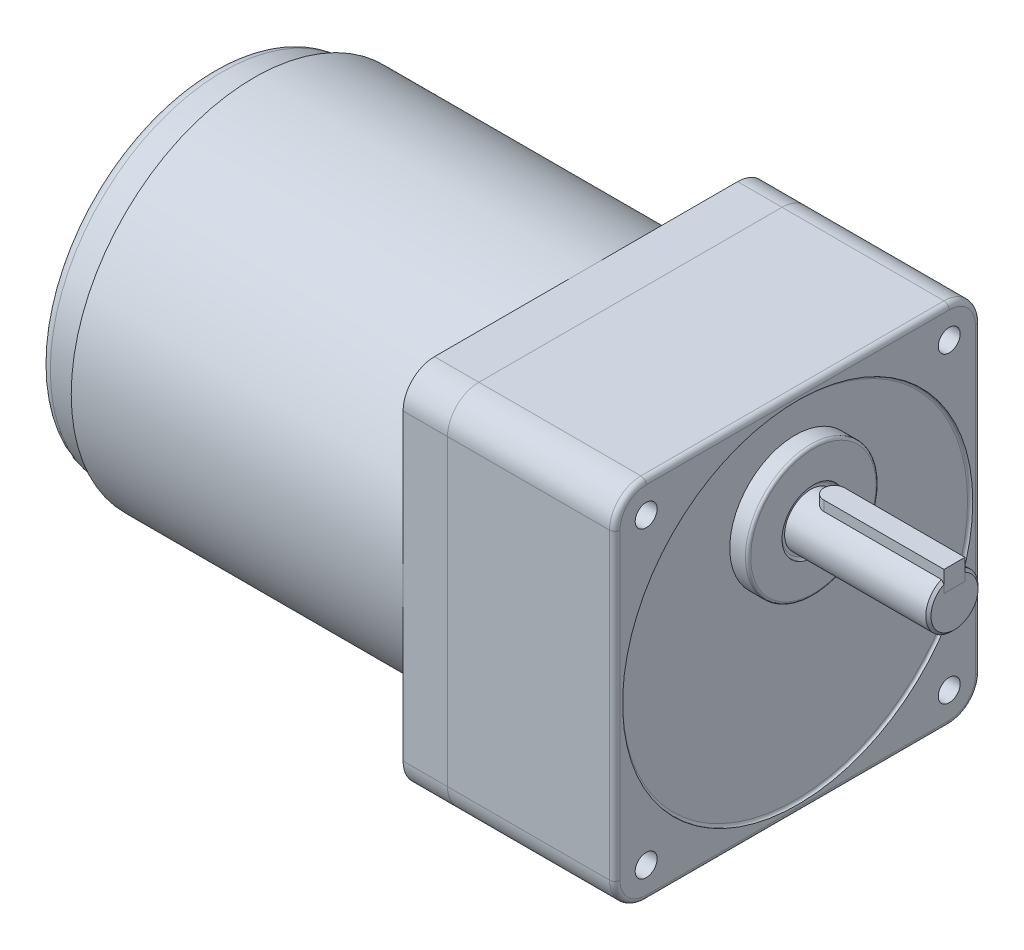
SolidWorks part; units mm, degrees
ref_plane "前视基准面" through (0, 0, 0) normal (0, 0, 1) x (1, 0, 0)
ref_plane "上视基准面" through (0, 0, 0) normal (0, 1, 0) x (1, 0, 0)
ref_plane "右视基准面" through (0, 0, 0) normal (1, 0, 0) x (0, 0, -1)
sketch "草图1" plane through (0, 0, 0) normal (1, 0, 0) x (0, 0, -1)
  line L1 (-29, -35) -> (29, -35)
  line L2 (-35, -29) -> (-35, 29)
  line L3 (-29, 35) -> (29, 35)
  line L4 (35, -29) -> (35, 29)
  line L5 (-35, -35) -> (35, 35) construction
  line L6 (-35, 35) -> (35, -35) construction
  arc A0 (-29, -35) -> (-35, -29) centre (-29, -29) cw
  arc A1 (29, -35) -> (35, -29) centre (29, -29) ccw
  arc A2 (29, 35) -> (35, 29) centre (29, 29) cw
  arc A3 (-35, 29) -> (-29, 35) centre (-29, 29) cw
  point P0 (0, 0)
  dimension "D1" = 6
extrude "凸台-拉伸1" add sketch "草图1" against normal blind 32
sketch "草图2" plane through (-32, 0, 0) normal (-1, 0, 0) x (0, 0, 1)
  line L0 (-29, 35) -> (29, 35) construction
  line L1 (-29, -35) -> (29, -35)
  line L2 (-35, -29) -> (-35, 29)
  line L3 (-29, 35) -> (29, 35)
  line L4 (35, -29) -> (35, 29)
  line L5 (-35, -35) -> (35, 35) construction
  line L6 (-35, 35) -> (35, -35) construction
  arc A0 (29, 35) -> (35, 29) centre (29, 29) cw
  arc A1 (29, -35) -> (35, -29) centre (29, -29) ccw
  arc A2 (-29, -35) -> (-35, -29) centre (-29, -29) cw
  arc A3 (-35, 29) -> (-29, 35) centre (-29, 29) cw
  point P0 (0, 0)
  dimension "D1" = 6
extrude "凸台-拉伸2" add sketch "草图2" along normal blind 8.5 separate body
sketch "草图3" plane through (-40.5, 0, 0) normal (-1, 0, 0) x (0, 0, 1)
  circle A0 centre (0, 0) radius 35
extrude "凸台-拉伸3" add sketch "草图3" along normal blind 63.5
sketch "草图4" plane through (-104, 0, 0) normal (-1, 0, 0) x (0, 0, 1)
  circle A0 centre (0, 0) radius 33
extrude "凸台-拉伸4" add sketch "草图4" along normal blind 8
fillet "圆角1" radius 2 1 edges at (-112, 0, 33)
fillet "圆角2" radius 1 8 edges at (0, 0, 35) (0, 33.2426, 33.2426) (0, 35, 0) (0, 33.2426, -33.2426) (0, 0, -35) (0, -33.2426, -33.2426) (0, -35, 0) (0, -33.2426, 33.2426)
sketch "草图5" plane through (0, 0, 0) normal (1, 0, 0) x (0, 0, -1)
  point P10 (-28.9914, 28.9914)
  point P11 (28.9914, 28.9914)
  point P12 (28.9914, -28.9914)
  point P13 (-28.9914, -28.9914)
hole_wizard "M5 螺纹孔1" positions "3D草图1" profile "草图6" tap size "M5" standard "GB"
sketch3d "3D草图1"
  point P0 (0, 28.9914, 28.9914)
  point P3 (0, 28.9914, -28.9914)
  point P6 (0, -28.9914, -28.9914)
  point P9 (0, -28.9914, 28.9914)
sketch "草图6" plane through (0, 28.9914, 28.9914) normal (0, 1, 0) x (0, 0, -1)
  line L0 (0, 0) -> (0, 15.2618)
  line L1 (0, 15.2618) -> (2.1, 14)
  line L2 (2.1, 14) -> (2.1, 0)
  line L5 (2.1, 0) -> (0, 0)
  line L10 (0, 15.2618) -> (-2.1, 14) construction
  line L11 (0, -6.35) -> (0, 107.95) construction
  dimension "螺纹孔钻头直径" = 4.2
  dimension "螺纹孔钻头深度" = 14
  dimension "导头角度" = 118
sketch "草图7" plane through (0, 0, 0) normal (1, 0, 0) x (0, 0, -1)
  circle A0 centre (0, 0) radius 33.5
extrude "切除-拉伸1" cut sketch "草图7" against normal blind 0.5
fillet "圆角3" radius 0.5 1 edges at (-0.5, 0, -33.5)
sketch "草图8" plane through (-0.5, 0, 0) normal (1, 0, 0) x (0, 0, -1)
  circle A0 centre (0, 15) radius 12.5
extrude "凸台-拉伸5" add sketch "草图8" along normal blind 3.5
fillet "圆角4" radius 0.5 1 edges at (3, 15, -12.5)
sketch "草图9" plane through (3, 0, 0) normal (1, 0, 0) x (0, 0, -1)
  circle A0 centre (0, 15) radius 6
extrude "切除-拉伸2" cut sketch "草图9" against normal blind 0.5
fillet "圆角5" radius 0.5 1 edges at (2.5, 15, -6)
sketch "草图10" plane through (2.5, 0, 0) normal (1, 0, 0) x (0, 0, -1)
  circle A0 centre (0, 15) radius 5
extrude "凸台-拉伸6" add sketch "草图10" along normal blind 27.5
ref_plane "基准面1" through (0, 20, 0) normal (0, 1, 0) x (1, 0, 0)
sketch "草图11" plane through (0, 20, 0) normal (0, 1, 0) x (1, 0, 0)
  line L1 (30, -5) -> (30, 5) construction
  line L2 (7, 2) -> (30, 2)
  line L3 (30, 2) -> (30, -2)
  line L4 (30, -2) -> (7, -2)
  arc A0 (7, 2) -> (7, -2) centre (7, 0) ccw
extrude "切除-拉伸3" cut sketch "草图11" against normal blind 2.5
sketch "草图12" plane through (0, 17.5, 0) normal (0, 1, 0) x (1, 0, 0)
  line L0 (7, 2) -> (30, 2)
  line L1 (30, 2) -> (30, -2)
  line L2 (30, -2) -> (7, -2)
  arc A0 (7, 2) -> (7, -2) centre (7, 0) ccw
extrude "凸台-拉伸7" add sketch "草图12" along normal blind 4 separate body
chamfer "倒角1" distance 0.5 angle 45 1 edges at (30, 10, 0)
